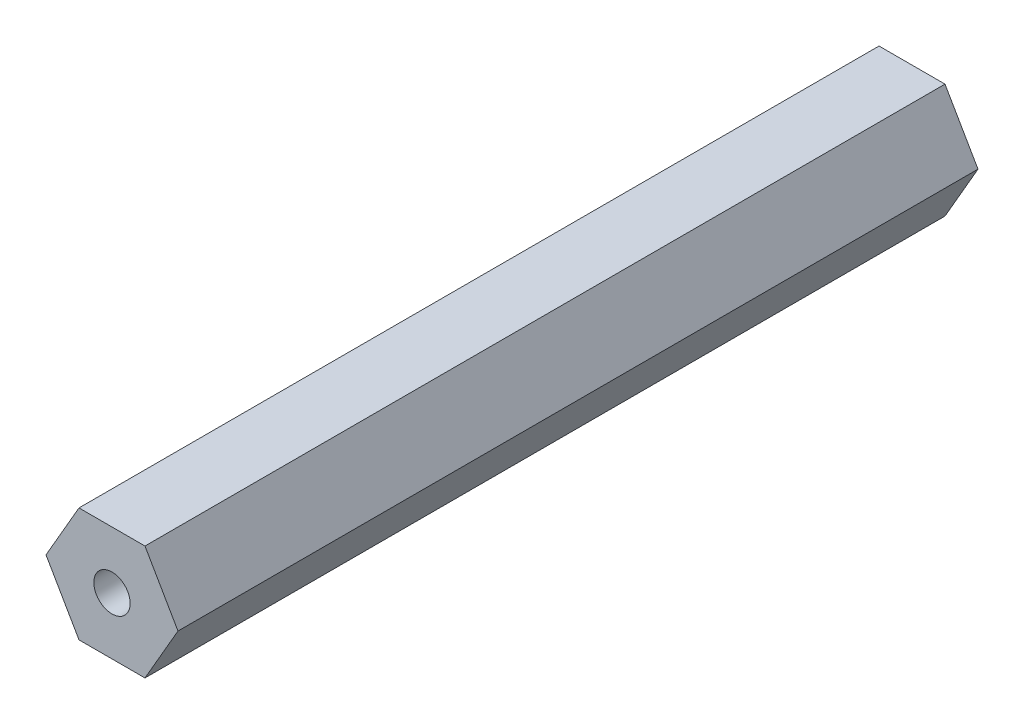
SolidWorks part; units mm, degrees
ref_plane "Front Plane" through (0, 0, 0) normal (0, 0, 1) x (1, 0, 0)
ref_plane "Top Plane" through (0, 0, 0) normal (0, 1, 0) x (1, 0, 0)
ref_plane "Right Plane" through (0, 0, 0) normal (1, 0, 0) x (0, 0, -1)
sketch "Sketch2" plane through (0, 0, 0) normal (0, 0, 1) x (1, 0, 0)
  line L1 (7.3323, 0) -> (3.6662, 6.35)
  line L2 (3.6662, 6.35) -> (-3.6662, 6.35)
  line L3 (-3.6662, 6.35) -> (-7.3323, 0)
  line L4 (-7.3323, 0) -> (-3.6662, -6.35)
  line L5 (-3.6662, -6.35) -> (3.6662, -6.35)
  line L6 (3.6662, -6.35) -> (7.3323, 0)
  circle A0 centre (0, 0) radius 6.35 construction
  dimension "D1" = 12.7
extrude "Boss-Extrude1" add sketch "Sketch2" along normal blind 88.9
sketch "Sketch5" plane through (0, 0, 88.9) normal (0, 0, 1) x (1, 0, 0)
  point P0 (0, 0)
sketch "Sketch6" plane through (0, 0, 0) normal (0, 0, -1) x (-1, 0, 0)
  line L0 (-3.6662, 6.35) -> (3.6662, -6.35) construction
  line L1 (-3.6662, -6.35) -> (3.6662, 6.35) construction
  point P8 (0, 0)
hole_wizard "#10-32 Tapped Hole1" positions "3DSketch2" profile "Sketch7" tap size "#10-32" standard "ANSI Inch"
sketch3d "3DSketch2"
  line L0 (3.6662, 6.35, 0) -> (-3.6662, -6.35, 0) construction
  point P0 (0, 0, 0)
  point P3 (0, 0, 0)
  point P6 (0, 0, 0)
  point P10 (0, 0, 88.9)
  point P13 (0, 0, 0)
sketch "Sketch7" plane through (0, 0, 88.9) normal (1, 0, 0) x (0, -1, 0)
  line L0 (0, 0) -> (0, 13.9133)
  line L1 (0, 13.9133) -> (2.0193, 12.7)
  line L2 (2.0193, 12.7) -> (2.0193, 0)
  line L5 (2.0193, 0) -> (0, 0)
  line L10 (0, 13.9133) -> (-2.0193, 12.7) construction
  line L11 (0, -6.35) -> (0, 107.95) construction
  dimension "Tap Drill Dia." = 4.0386
  dimension "Tap Drill Depth" = 12.7
  dimension "Drill Angle" = 118
hole_wizard "#10-32 Tapped Hole2" positions "3DSketch3" profile "Sketch8" tap size "#10-32" standard "ANSI Inch"
sketch3d "3DSketch3"
  line L0 (3.6662, 6.35, 0) -> (-3.6662, -6.35, 0) construction
  line L1 (3.6662, -6.35, 0) -> (-3.6662, 6.35, 0) construction
  point P0 (0, 0, 0)
  point P3 (0, 0, 0)
  point P7 (0, 0, 0)
  point P9 (0, 0, 0)
  point P11 (0, 0, 0)
  point P13 (0, 0, 0)
  point P15 (0, 0, 0)
  point P17 (0, 0, 0)
  point P19 (0, 0, 0)
  point P21 (0, 0, 0)
  point P23 (0, 0, 0)
  point P27 (0, 0, 0)
sketch "Sketch8" plane through (0, 0, 0) normal (1, 0, 0) x (0, 1, 0)
  line L0 (0, 0) -> (0, 13.9133)
  line L1 (0, 13.9133) -> (2.0193, 12.7)
  line L2 (2.0193, 12.7) -> (2.0193, 0)
  line L5 (2.0193, 0) -> (0, 0)
  line L10 (0, 13.9133) -> (-2.0193, 12.7) construction
  line L11 (0, -6.35) -> (0, 107.95) construction
  dimension "Tap Drill Dia." = 4.0386
  dimension "Tap Drill Depth" = 12.7
  dimension "Drill Angle" = 118
